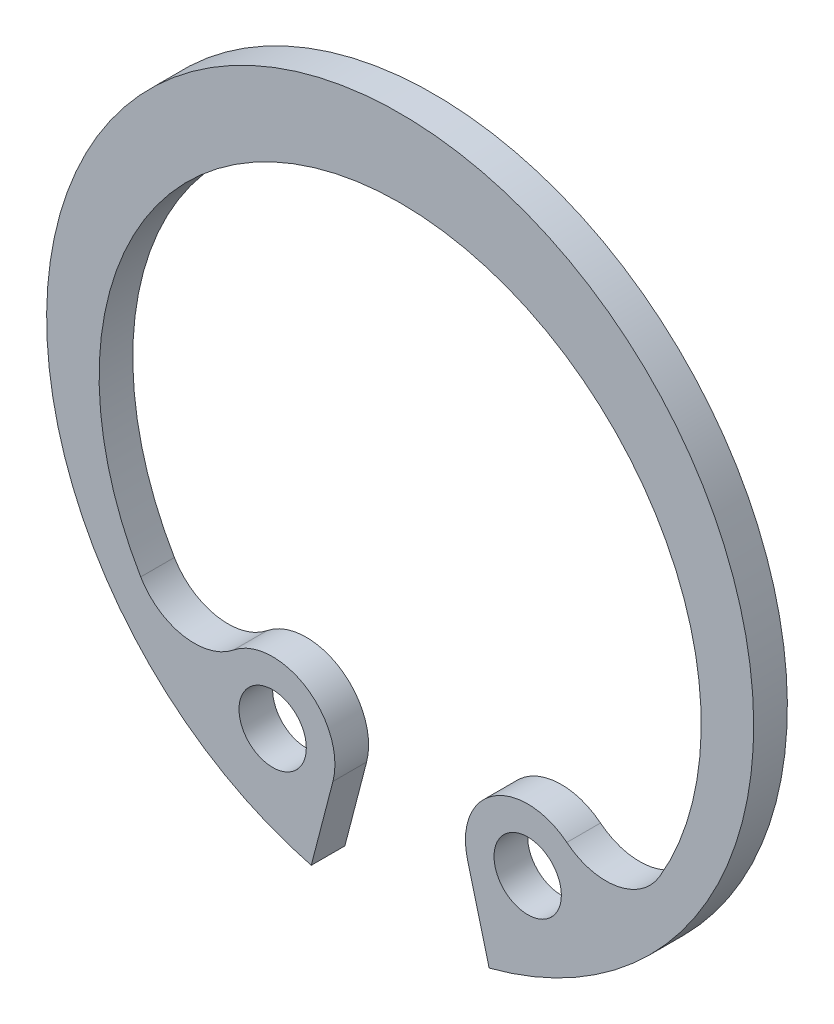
SolidWorks part; units mm, degrees
ref_plane "Plane1" through (0, 0, 0) normal (0, 0, 1) x (1, 0, 0)
ref_plane "Plane2" through (0, 0, 0) normal (0, 1, 0) x (1, 0, 0)
ref_plane "Plane3" through (0, 0, 0) normal (1, 0, 0) x (0, 0, -1)
sketch "Clipboard" plane through (0, 0, 0) normal (0, 0, 1) x (1, 0, 0)
  line L0 (0, 0) -> (2.3, 0)
  line L1 (0, 0) -> (0, 1.15)
  line L2 (0, 0) -> (0, -4.2)
  circle A0 centre (0, 0) radius 1
  circle A1 centre (0, 0) radius 10
  dimension "HoleDia" = 2
  dimension "BoreDia" = 20
  dimension "LargeSection" = 2.3
  dimension "SmallSection" = 1.15
  dimension "LugSection" = 4.2
sketch "BodySke" plane through (0, 0, 0) normal (0, 0, 1) x (1, 0, 0)
  line L0 (-1.5431, 0) -> (1.5431, 0) construction
  line L1 (0, 0) -> (0, 8.2) construction
  line L2 (2.6417, -10.1623) -> (1.9969, -7.682)
  line L3 (-2.6417, -10.1623) -> (-1.9969, -7.682)
  line L4 (0, 0) -> (8.5626, -6.0772) construction
  line L5 (0, 0) -> (-8.5626, -6.0772) construction
  line L6 (-3.5358, -6.2487) -> (-4.039, -8.1843) construction
  line L7 (3.5986, -6.4901) -> (3.9762, -7.943) construction
  arc A0 (-1.9969, -7.682) -> (-4.9496, -5.7771) centre (-3.7874, -7.2165) ccw
  arc A1 (4.9496, -5.7771) -> (1.9969, -7.682) centre (3.7874, -7.2165) ccw
  arc A2 (7.6248, -5.4116) -> (-7.6248, -5.4116) centre (0, -0.7414) ccw construction
  arc A3 (2.6417, -10.1623) -> (-2.6417, -10.1623) centre (0, 0) ccw
  circle A4 centre (3.7874, -7.2165) radius 1
  circle A5 centre (-3.7874, -7.2165) radius 1
  circle A6 centre (3.7874, -7.2165) radius 1.85 construction
  arc A7 (7.7062, -5.276) -> (-7.7062, -5.276) centre (0, -0.7414) ccw
  arc A8 (-3.7874, -7.2165) -> (3.7874, -7.2165) centre (0, 0) ccw construction
  arc A9 (-7.7062, -5.276) -> (-4.9496, -5.7771) centre (-6.1118, -4.3377) ccw
  arc A10 (4.9496, -5.7771) -> (7.7062, -5.276) centre (6.1118, -4.3377) ccw
  dimension "GrooveDia" = 21
  dimension "TipRad" = 1.85
  dimension "HoleOffsetRad" = 8.15
  dimension "HoleDia" = 2
  dimension "FilletRad" = 1.85
  dimension "LargeRad" = 8.2
  dimension "SmallRad" = 9.35
  dimension "SmallAngle" = 109.271
  dimension "GapAngle" = 29.143
extrude "Body" add sketch "BodySke" against normal blind 1
sketch "ModLugSke" plane through (0, 0, 0) normal (0, 0, 1) x (1, 0, 0)
  line L0 (2.6417, -10.1623) -> (1.61, -6.1934)
  line L1 (-2.6417, -10.1623) -> (-1.61, -6.1934)
  line L2 (5.755, -2.5631) -> (9.5917, -4.2718) construction
  line L3 (-5.755, -2.5631) -> (-9.5917, -4.2718) construction
  line L4 (-2.6417, -10.1623) -> (-1.9969, -7.682) construction
  line L5 (1.9969, -7.682) -> (2.6417, -10.1623) construction
  line L6 (0, 0) -> (0, -18.0732) construction
  line L7 (8.4087, -3.7449) -> (9.5917, -4.2718)
  line L8 (-9.5917, -4.2718) -> (-8.4087, -3.7449)
  arc A0 (2.6417, -10.1623) -> (9.5917, -4.2718) centre (0, 0) ccw
  arc A1 (-3.9335, -4.9211) -> (-1.6801, -6.0718) centre (0, 0) ccw
  arc A2 (2.6417, -10.1623) -> (-2.6417, -10.1623) centre (0, 0) ccw construction
  arc A3 (4.9496, -5.7771) -> (1.9969, -7.682) centre (3.7874, -7.2165) ccw construction
  arc A4 (-3.9335, -4.9211) -> (-4.0545, -4.9182) centre (-3.9959, -4.9992) ccw
  arc A5 (-8.4087, -3.7449) -> (-4.0545, -4.9182) centre (-5.755, -2.5631) ccw
  arc A6 (7.7062, -5.276) -> (-7.7062, -5.276) centre (0, -0.7414) ccw construction
  arc A7 (4.0545, -4.9182) -> (8.4087, -3.7449) centre (5.755, -2.5631) ccw
  arc A8 (1.6801, -6.0718) -> (3.9335, -4.9211) centre (0, 0) ccw
  arc A9 (-9.5917, -4.2718) -> (-2.6417, -10.1623) centre (0, 0) ccw
  circle A10 centre (-3.7874, -7.2165) radius 1
  circle A11 centre (-3.7874, -7.2165) radius 1 construction
  circle A12 centre (3.7874, -7.2165) radius 1
  circle A13 centre (3.7874, -7.2165) radius 1 construction
  arc A14 (-1.6801, -6.0718) -> (-1.61, -6.1934) centre (-1.7067, -6.1682) cw
  arc A15 (1.6801, -6.0718) -> (1.61, -6.1934) centre (1.7067, -6.1682) ccw
  arc A16 (3.9335, -4.9211) -> (4.0545, -4.9182) centre (3.9959, -4.9992) cw
  point P43 (1.585, -6.0974)
  dimension "D1" = 0.1
  dimension "LugAng" = 77.271
extrude "ModLug" [suppressed] add sketch "ModLugSke" against normal through all
sketch "UnlSke" [suppressed] plane through (0, 0, 0) normal (0, 0, 1) x (1, 0, 0)
  line L0 (2.1178, -8.3352) -> (3.2259, -12.6966)
  line L1 (-2.1178, -8.3352) -> (-3.2259, -12.6966)
  line L2 (-3.2259, -12.6966) -> (-2.1422, -8.4315) construction
  line L3 (2.1422, -8.4315) -> (3.2259, -12.6966) construction
  arc A0 (2.1178, -8.3352) -> (-2.1178, -8.3352) centre (0, 0) ccw
  arc A1 (3.2259, -12.6966) -> (-3.2259, -12.6966) centre (0, 0) ccw
  arc A2 (3.2259, -12.6966) -> (-3.2259, -12.6966) centre (0, 0) ccw construction
  circle A4 centre (-4.4431, -9.5688) radius 1
  circle A5 centre (4.4431, -9.5688) radius 1
  circle A6 centre (4.4431, -9.5688) radius 1 construction
  circle A7 centre (-4.4431, -9.5688) radius 1 construction
  arc A8 (2.2134, -8.3103) -> (4.9183, -7.0548) centre (0, 0) ccw construction
extrude "Unlug" [suppressed] add sketch "UnlSke" against normal through all
equation "' \"BoreDia@Clipboard\" = 8"
equation "' \"Thickness@Body\" = 0.8"
equation "' \"GrooveDia@BodySke\" = 8.4"
equation "' \"LugSection@Clipboard\" = 2.4"
equation "' \"LargeSection@Clipboard\" = 1.1"
equation "' \"HoleDia@Clipboard\" = 1.0"
equation "' \"BoreDia@Clipboard\" = 25"
equation "' \"Thickness@Body\" = 1.2"
equation "' \"GrooveDia@BodySke\" = 26.2"
equation "' \"LugSection@Clipboard\" = 4.5"
equation "' \"LargeSection@Clipboard\" = 2.7"
equation "' \"HoleDia@Clipboard\" = 2"
equation "\"SmallSection@Clipboard\" = \"LargeSection@Clipboard\" * 0.5"
equation "\"TipRad@BodySke\" = (\"LugSection@Clipboard\" - (\"GrooveDia@BodySke\" / 2  -  \"BoreDia@Clipboard\" / 2 ) ) / 2"
equation "\"HoleOffsetRad@BodySke\" = (\"GrooveDia@BodySke\" / 2) - \"LugSection@Clipboard\"  + \"TipRad@BodySke\""
equation "\"LargeRad@BodySke\" =  \"GrooveDia@BodySke\" / 2 -  \"LargeSection@Clipboard\""
equation "\"SmallRad@BodySke\" =  \"GrooveDia@BodySke\" / 2 -  \"SmallSection@Clipboard\""
equation "\"HoleDia@BodySke\" =  \"HoleDia@Clipboard\""
equation "\"FilletRad@BodySke\" = \"TipRad@BodySke\" * 1.0"
equation "\"GapAngle@BodySke\" = 360 - 0.965 * 360 * ( \"BoreDia@Clipboard\" /  \"GrooveDia@BodySke\")"
equation "\"LugAng@ModLugSke\" = \"GapAngle@BodySke\"  + 2 * 360 * (\"LugSection@Clipboard\" / (\"BoreDia@Clipboard\" * 3.1416))"
